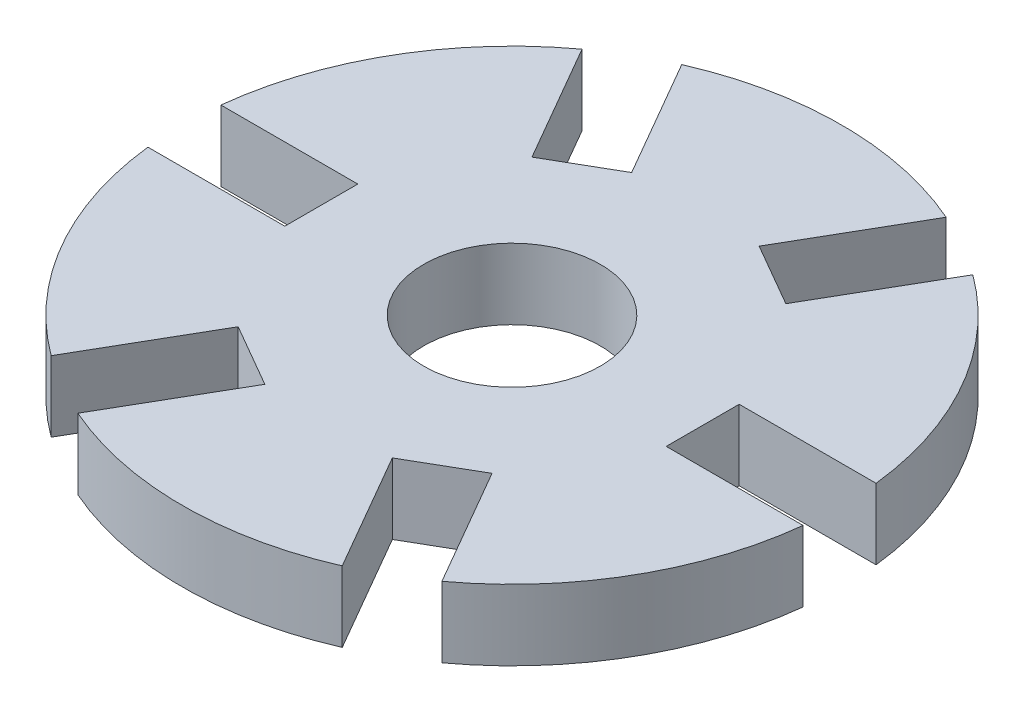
SolidWorks part; units mm, degrees
ref_plane "Front" through (0, 0, 0) normal (0, 0, 1) x (1, 0, 0)
ref_plane "Top" through (0, 0, 0) normal (0, 1, 0) x (1, 0, 0)
ref_plane "Right" through (0, 0, 0) normal (1, 0, 0) x (0, 0, -1)
sketch "Sketch1" plane through (0, 0, 0) normal (0, 1, 0) x (1, 0, 0)
  circle A0 centre (0, 0) radius 28
  dimension "D1" = 28
extrude "Boss-Extrude1" add sketch "Sketch1" along normal blind 6
sketch "Sketch2" plane through (0, 6, 0) normal (0, 1, 0) x (1, 0, 0)
  circle A0 centre (0, 0) radius 7.5
  dimension "D1" = 15
extrude "central bore" cut sketch "Sketch2" against normal through all
sketch "Sketch4" plane through (0, 6, 0) normal (0, 1, 0) x (1, 0, 0)
  line L0 (0, 0) -> (16.2, 0) construction
  line L1 (16.2, 3.1) -> (28, 3.1)
  line L2 (16.2, 3.1) -> (16.2, -3.1)
  line L3 (16.2, -3.1) -> (28, -3.1)
  line L4 (28, 3.1) -> (28, -3.1)
  circle A0 centre (0, 0) radius 28 construction
  dimension "D2" = 6.2
  dimension "D3" = 16.2
extrude "bearing wedge slots" cut sketch "Sketch4" against normal up to next
pattern_circular "wedge slot pattern" count 6 over 360 about axis through (0, 0, 0) along (0, 1, 0) of "bearing wedge slots"
